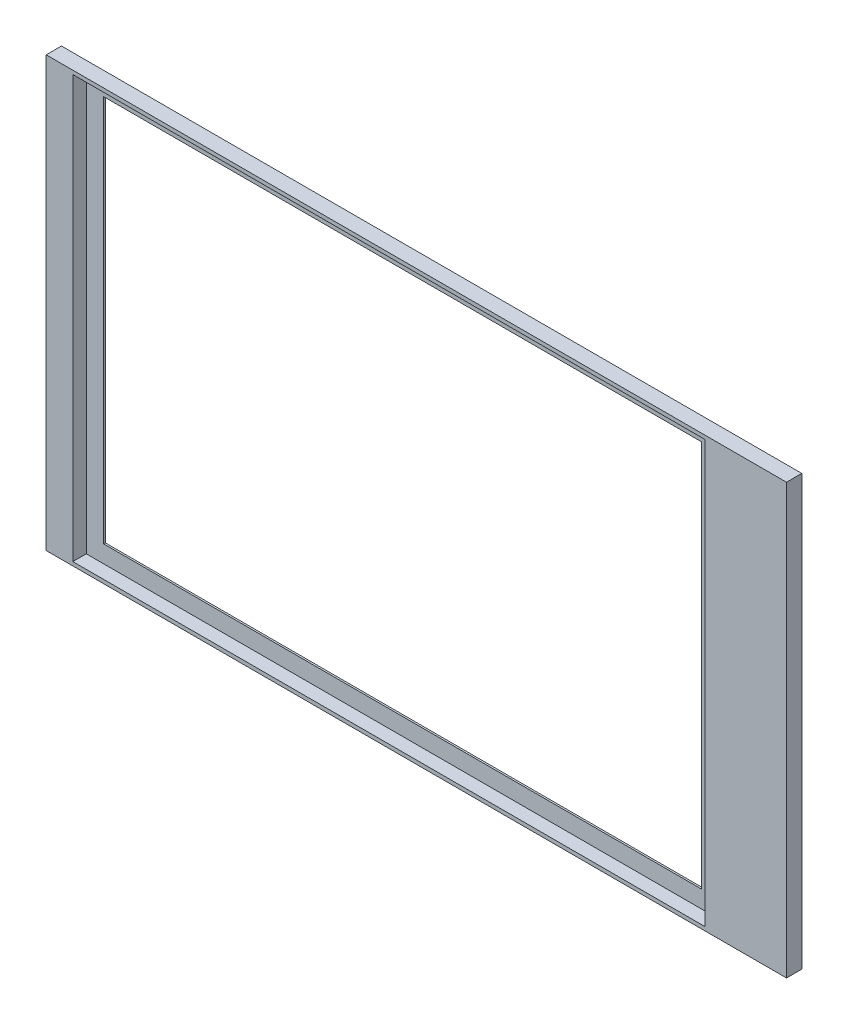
SolidWorks part; units mm, degrees
ref_plane "Alzado" through (0, 0, 0) normal (0, 0, 1) x (1, 0, 0)
ref_plane "Planta" through (0, 0, 0) normal (0, 1, 0) x (1, 0, 0)
ref_plane "Vista lateral" through (0, 0, 0) normal (1, 0, 0) x (0, 0, -1)
sketch "Croquis1" plane through (0, 0, 0) normal (0, 0, 1) x (1, 0, 0)
  line L1 (0, 0) -> (1191.5, 0)
  line L2 (0, 0) -> (0, 723)
  line L3 (0, 723) -> (1191.5, 723)
  line L4 (1191.5, 0) -> (1191.5, 723)
  dimension "D1" = 1191.5
  dimension "D2" = 723
extrude "Saliente-Extruir1" add sketch "Croquis1" along normal blind 23
sketch "Croquis2" plane through (0, 0, 0) normal (0, 0, -1) x (-1, 0, 0)
  line L0 (0, 723) -> (0, 0) construction
  line L1 (-1191.5, 723) -> (0, 723)
  line L2 (-1191.5, 723) -> (-1191.5, 685)
  line L3 (-1191.5, 685) -> (0, 685)
  line L4 (0, 723) -> (0, 685)
  line L6 (-1191.5, 0) -> (0, 0)
  line L7 (-1191.5, 0) -> (-1191.5, 38)
  line L8 (-1191.5, 38) -> (0, 38)
  line L9 (0, 0) -> (0, 38)
  dimension "D1" = 38
  dimension "D2" = 1191.5
  dimension "D3" = 38
extrude "Cortar-Extruir1" cut sketch "Croquis2" against normal blind 20.34
sketch "Croquis3" plane through (0, 0, 23) normal (0, 0, 1) x (1, 0, 0)
  line L7 (78, 43.66) -> (1031, 43.66)
  line L8 (78, 43.66) -> (78, 679.34)
  line L9 (78, 679.34) -> (1031, 679.34)
  line L10 (1031, 43.66) -> (1031, 679.34)
  dimension "D1" = 635.68
  dimension "D2" = 953
extrude "Cortar-Extruir2" cut sketch "Croquis3" against normal blind 20.34
sketch "Croquis5" plane through (0, 0, 2.66) normal (0, 0, 1) x (1, 0, 0)
  line L7 (104, 653.34) -> (1005, 653.34)
  line L8 (104, 653.34) -> (104, 69.66)
  line L9 (104, 69.66) -> (1005, 69.66)
  line L10 (1005, 653.34) -> (1005, 69.66)
  dimension "D1" = 901
  dimension "D2" = 583.68
extrude "Cortar-Extruir4" cut sketch "Croquis5" against normal up to next
sketch "Croquis6" plane through (0, 0, 0) normal (-1, 0, 0) x (0, 0, 1)
  circle A0 centre (12.75, 81.25) radius 4.7625
  circle A1 centre (12.75, 46.25) radius 4.7625
  circle A2 centre (12.75, 116.25) radius 4.7625
  circle A3 centre (12.75, 151.25) radius 4.7625
  circle A4 centre (12.75, 186.25) radius 4.7625
  circle A5 centre (12.75, 221.25) radius 4.7625
  circle A6 centre (12.75, 256.25) radius 4.7625
  circle A7 centre (12.75, 291.25) radius 4.7625
  circle A8 centre (12.75, 326.25) radius 4.7625
  circle A9 centre (12.75, 361.25) radius 4.7625
  circle A10 centre (12.75, 396.25) radius 4.7625
  circle A11 centre (12.75, 431.25) radius 4.7625
  circle A12 centre (12.75, 466.25) radius 4.7625
  circle A13 centre (12.75, 501.25) radius 4.7625
  circle A14 centre (12.75, 536.25) radius 4.7625
  circle A15 centre (12.75, 571.25) radius 4.7625
  circle A16 centre (12.75, 606.25) radius 4.7625
  circle A17 centre (12.75, 641.25) radius 4.7625
  circle A18 centre (12.75, 676.25) radius 4.7625
  dimension "D1" = 10.25
  dimension "D4" = 9.525
  dimension "D2" = 46.25
  dimension "D3" = 19
extrude "Cortar-Extruir5" cut sketch "Croquis6" against normal blind 65
sketch "Croquis7" plane through (1191.5, 0, 0) normal (1, 0, 0) x (0, 0, -1)
  line L0 (-23, 0) -> (-23, 723) construction
  line L1 (0, 685) -> (-23, 685)
  line L2 (0, 685) -> (0, 38)
  line L3 (0, 38) -> (-23, 38)
  line L4 (-23, 685) -> (-23, 38)
extrude "Cortar-Extruir6" cut sketch "Croquis7" against normal blind 38
sketch "Croquis8" plane through (0, 0, 20.34) normal (0, 0, -1) x (-1, 0, 0)
  line L1 (-1191.5, 0) -> (0, 0)
  line L2 (-1191.5, 0) -> (-1191.5, 38)
  line L3 (-1191.5, 38) -> (0, 38)
  line L4 (0, 0) -> (0, 38)
extrude "Cortar-Extruir7" cut sketch "Croquis8" against normal up to next
sketch "Croquis9" plane through (0, 0, 20.34) normal (0, 0, -1) x (-1, 0, 0)
  line L1 (-1191.5, 685) -> (0, 685)
  line L2 (-1191.5, 685) -> (-1191.5, 723)
  line L3 (-1191.5, 723) -> (0, 723)
  line L4 (0, 685) -> (0, 723)
extrude "Cortar-Extruir8" cut sketch "Croquis9" against normal blind 10
sketch "Croquis10" plane through (0, 0, 23) normal (0, 0, 1) x (1, 0, 0)
  line L0 (1153.5, 685) -> (0, 685) construction
  line L1 (0, 38) -> (6, 38)
  line L2 (0, 38) -> (0, 685)
  line L3 (0, 685) -> (6, 685)
  line L4 (6, 38) -> (6, 685)
  dimension "D1" = 6
extrude "Cortar-Extruir9" cut sketch "Croquis10" against normal up to next
sketch "Croquis11" plane through (0, 0, 23) normal (0, 0, 1) x (1, 0, 0)
  line L0 (1153.5, 685) -> (6, 685) construction
  line L1 (6, 38) -> (38, 38)
  line L2 (6, 38) -> (6, 685)
  line L3 (6, 685) -> (38, 685)
  line L4 (38, 38) -> (38, 685)
  dimension "D1" = 32
extrude "Cortar-Extruir10" cut sketch "Croquis11" against normal up to next
